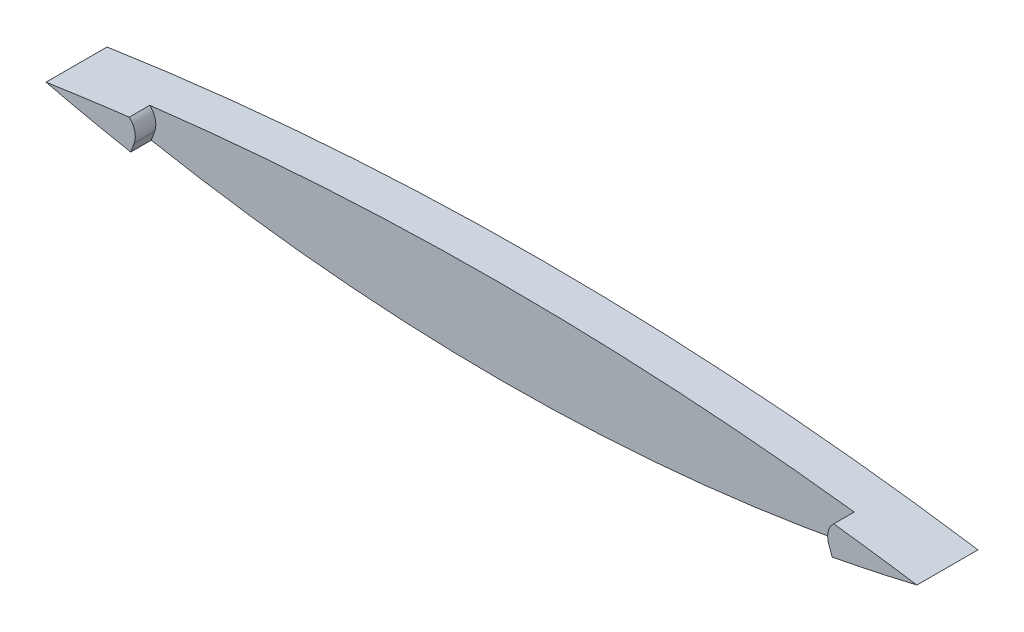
SolidWorks part; units mm, degrees
ref_plane "Front Plane" through (0, 0, 0) normal (0, 0, 1) x (1, 0, 0)
ref_plane "Top Plane" through (0, 0, 0) normal (0, 1, 0) x (1, 0, 0)
ref_plane "Right Plane" through (0, 0, 0) normal (1, 0, 0) x (0, 0, -1)
sketch "Sketch1" plane through (0, 0, 0) normal (0, 0, 1) x (1, 0, 0)
  line L0 (-23.3537, 0) -> (23.3537, 0) construction
  arc A0 (-23.3537, 0) -> (23.3537, 0) centre (0, 97.9392) ccw
  arc A1 (23.3537, 0) -> (-23.3537, 0) centre (0, -154.5216) ccw
  dimension "D1" = 100.685
  dimension "D2" = 156.2764
  dimension "D3" = 46.7073
extrude "Extrude1" add sketch "Sketch1" along normal mid plane 2.1721
sketch "Sketch5" plane through (0, 0, 1.086) normal (0, 0, 1) x (1, 0, 0)
  line L1 (-18.8083, -0.9735) -> (-18.625, -0.4701)
  line L2 (-18.8083, -0.9735) -> (-20.4607, -0.6593) construction
  line L3 (18.8083, -0.9735) -> (20.4607, -0.6593) construction
  line L4 (0, 3.966) -> (0, -7.081) construction
  line L5 (18.8083, -0.9735) -> (18.625, -0.4701)
  arc A1 (-18.625, -0.4701) -> (-18.8889, 0.6091) centre (-19.5647, -0.128) ccw
  arc A4 (18.8889, 0.6091) -> (23.3537, 0) centre (0, -154.5216) cw
  arc A5 (23.3537, 0) -> (-23.3537, 0) centre (0, -154.5216) ccw construction
  arc A6 (-23.3537, 0) -> (23.3537, 0) centre (0, 97.9392) ccw construction
  arc A7 (23.3537, 0) -> (18.8083, -0.9735) centre (0, 97.9392) cw
  arc A8 (-23.3537, 0) -> (-18.8083, -0.9735) centre (0, 97.9392) ccw
  arc A9 (-18.8889, 0.6091) -> (-23.3537, 0) centre (0, -154.5216) ccw
  arc A10 (18.625, -0.4701) -> (18.8889, 0.6091) centre (19.5647, -0.128) cw
  dimension "D5" = 1
  dimension "D3" = 99.234
  dimension "D1" = 4.5061
  dimension "D2" = 4.6485
  dimension "D4" = 0.5358
extrude "Extrude2" add sketch "Sketch5" along normal blind 1.1
